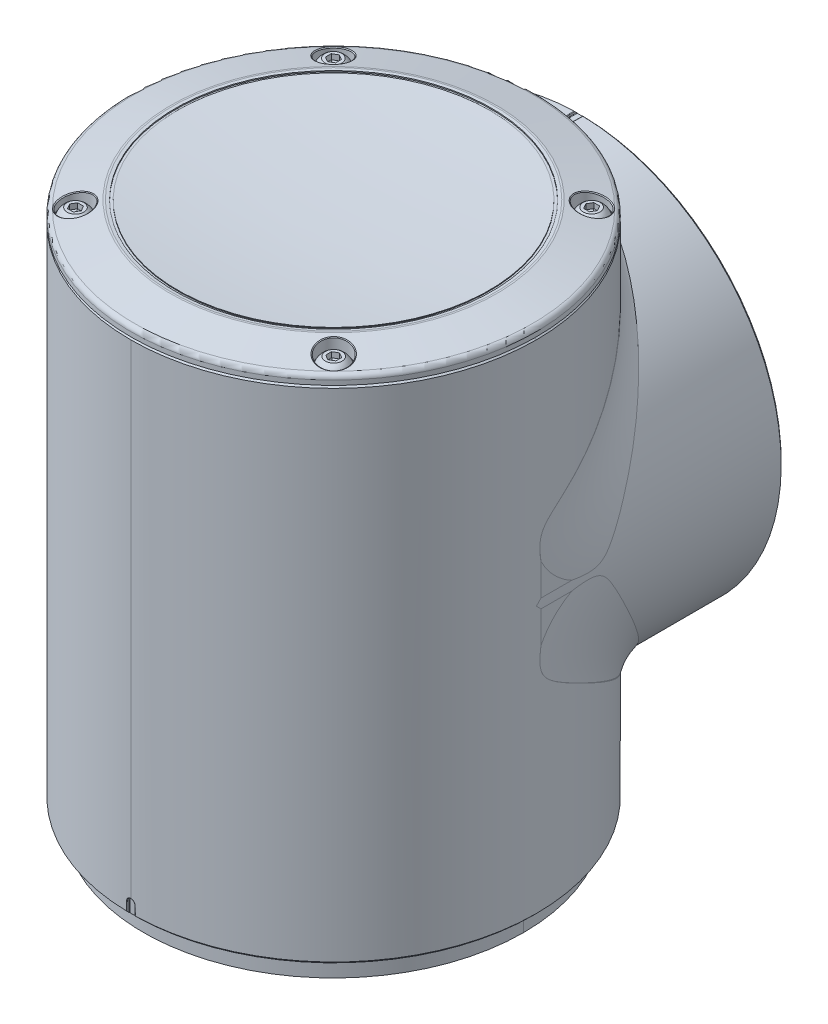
SolidWorks part; units mm, degrees
other "<4.0.07.2008582>-<输入1>"
ref_plane "前视基准面" through (0, 0, 0) normal (0, 0, 1) x (1, 0, 0)
ref_plane "上视基准面" through (0, 0, 0) normal (0, 1, 0) x (1, 0, 0)
ref_plane "右视基准面" through (0, 0, 0) normal (1, 0, 0) x (0, 0, -1)
imported_body "FR5-V6.0-922-5-1-solid1"
imported_body "FR5-V6.0-922-14关节后盖-1-solid1"
other "删除面1"
ref_plane "前视基准面-4.0.07.2008582" through (-794.5393, 200.15, 127.441) normal (0, 0, 1) x (0, -1, 0)
ref_plane "上视基准面-4.0.07.2008582" through (-794.5393, 200.15, 127.441) normal (1, 0, 0) x (0, -1, 0)
ref_plane "右视基准面-4.0.07.2008582" through (-794.5393, 200.15, 127.441) normal (0, -1, 0) x (0, 0, -1)
inserted part "4.0.07.2008582"
move or copy body "实体-移动/复制2"
pattern_circular "阵列(圆周)1" count 4 over 360 about axis through (-820.01, 0, 102) along (0, 1, 0)
